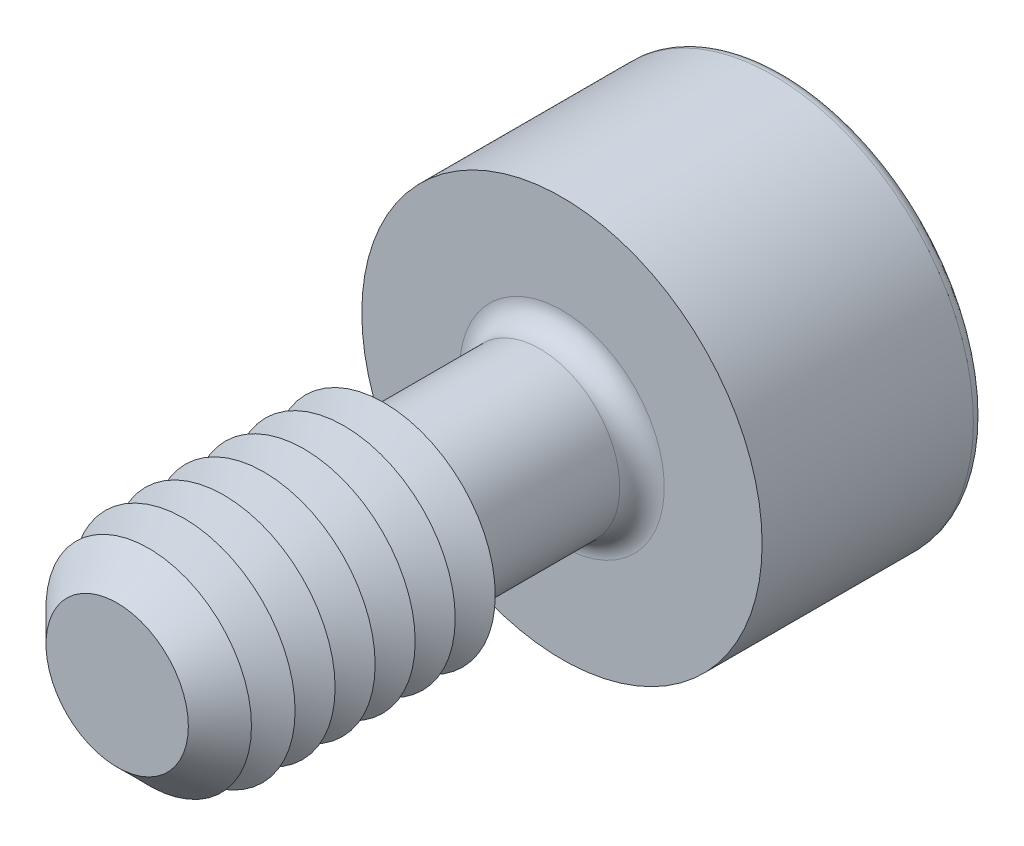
SolidWorks part; units mm, degrees
ref_plane "Front Plane" through (0, 0, 0) normal (0, 0, 1) x (1, 0, 0)
ref_plane "Top Plane" through (0, 0, 0) normal (0, 1, 0) x (1, 0, 0)
ref_plane "Right Plane" through (0, 0, 0) normal (1, 0, 0) x (0, 0, -1)
sketch "Sketch1" plane through (0, 0, 0) normal (0, 0, 1) x (1, 0, 0)
  circle A0 centre (0, 0) radius 0.9
  dimension "D1" = 1.8
extrude "Extrude1" add sketch "Sketch1" along normal mid plane 5
sketch "Sketch2" plane through (0, 0, 0) normal (1, 0, 0) x (0, 0, -1)
  line L0 (-2.5, 0) -> (-2.5, 1.25)
  line L1 (-2.5, 0.9) -> (-2.5, -0.9) construction
  line L2 (-2.5, 1.25) -> (0.5, 1.25)
  line L3 (0.5, 1.25) -> (0.7021, 0.9)
  line L4 (2.5, 0.9) -> (-2.5, 0.9) construction
  line L5 (0.7021, 0.9) -> (0.7021, 0)
  line L6 (0.7021, 0) -> (-2.5, 0)
  dimension "D1" = 1.25
  dimension "D2" = 120
  dimension "D3" = 3
revolve "Revolve1" add sketch "Sketch2" angle 360 about L6
chamfer "Chamfer1" distance 0.45 angle 45 1 edges at (0, 1.25, 2.5)
sketch "Sketch3" plane through (0, 0, -2.5) normal (0, 0, -1) x (-1, 0, 0)
  circle A0 centre (0, 0) radius 2.25
  dimension "D1" = 4.5
extrude "Extrude2" add sketch "Sketch3" along normal blind 2.5
sketch "Sketch4" plane through (-13.7, 0, -5) normal (0, 0, 1) x (1, 0, 0)
  line L2 (13.1226, -1) -> (14.2774, -1)
  line L3 (14.2774, -1) -> (14.8547, 0)
  line L4 (14.8547, 0) -> (14.2774, 1)
  line L6 (14.2774, 1) -> (13.1226, 1)
  line L7 (13.1226, 1) -> (12.5453, 0)
  line L8 (12.5453, 0) -> (13.1226, -1)
  circle A0 centre (13.7, 0) radius 1 construction
  dimension "D1" = 2
extrude "Extrude3" cut sketch "Sketch4" along normal blind 2
fillet "Fillet1" radius 0.25 1 edges at (-0.9, 0, -2.5)
fillet "Fillet2" radius 0.125 1 edges at (-2.25, 0, -5)
sketch "Sketch5" plane through (0, 0, 0) normal (1, 0, 0) x (0, 0, -1)
  line L0 (3, 0) -> (3, -1)
  line L1 (3, -1) -> (2.4226, 0)
  line L2 (2.4226, 0) -> (3, 0)
  dimension "D1" = 30
revolve "Cut-Revolve1" cut sketch "Sketch5" angle 360 about L2
sketch "Sketch6" plane through (0, 0, 0) normal (1, 0, 0) x (0, 0, -1)
  line L0 (1.332, 0) -> (-13.289, 0) construction
sketch "Sketch7" plane through (0, 0, 0) normal (1, 0, 0) x (0, 0, -1)
  line L0 (0.5, 1.25) -> (0.275, 0.8603)
  line L1 (0.275, 0.8603) -> (0.05, 1.25)
  line L2 (0.5, 1.25) -> (-2.05, 1.25) construction
  line L3 (0.05, 1.25) -> (0.5, 1.25)
  dimension "D1" = 0.45
revolve "Cut-Revolve2" cut sketch "Sketch7" angle 360 about L0
pattern_linear "LPattern1" count 6 spacing 0.45 along (0, 0, 1) of "Cut-Revolve2"
